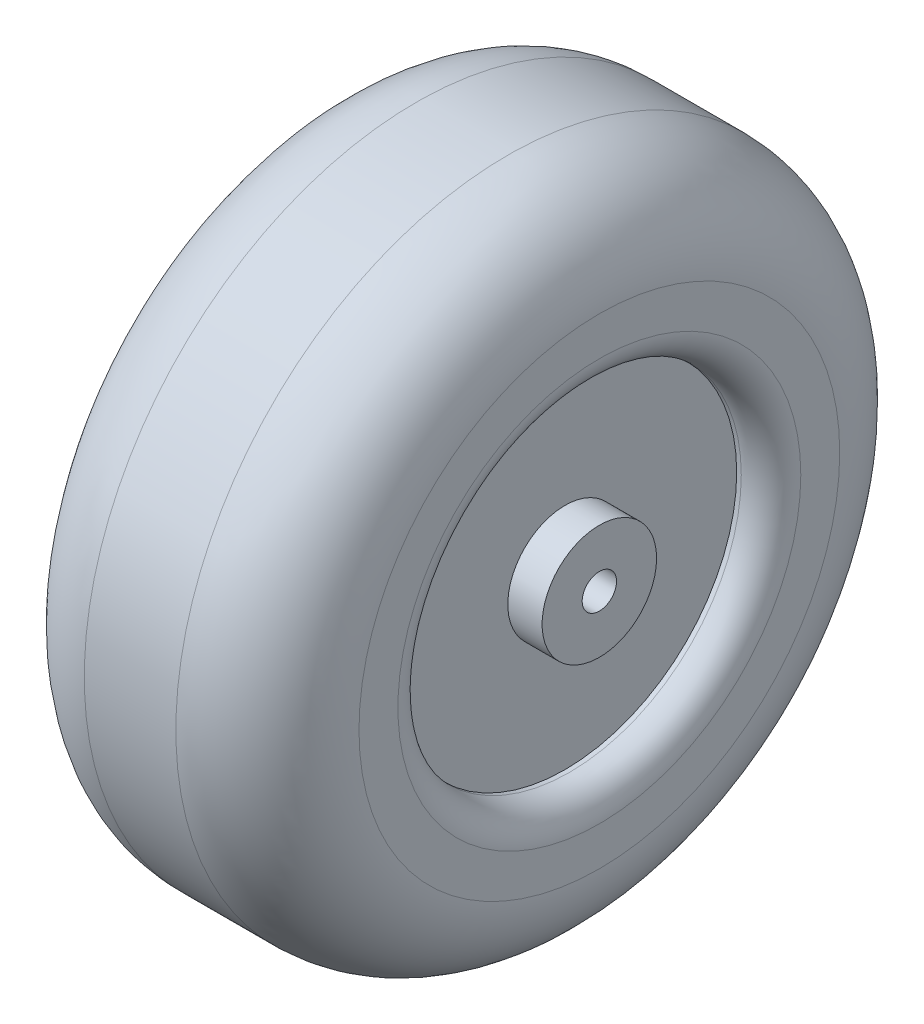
SolidWorks part; units mm, degrees
ref_plane "Plan de face" through (0, 0, 0) normal (0, 0, 1) x (1, 0, 0)
ref_plane "Plan de dessus" through (0, 0, 0) normal (0, 1, 0) x (1, 0, 0)
ref_plane "Plan de droite" through (0, 0, 0) normal (1, 0, 0) x (0, 0, -1)
sketch "Esquisse3" plane through (0, 0, 0) normal (1, 0, 0) x (0, 0, -1)
  circle A0 centre (0, 0) radius 14.5
  circle A1 centre (0, 0) radius 0.75
extrude "Boss.-Extru.1" add sketch "Esquisse3" along normal blind 12
sketch "Esquisse4" plane through (12, 0, 0) normal (1, 0, 0) x (0, 0, -1)
  circle A0 centre (0, 0) radius 2.5
  circle A1 centre (0, 0) radius 7.5
extrude "Enlèv. mat.-Extru.1" cut sketch "Esquisse4" against normal blind 1.5
sketch "Esquisse5" plane through (0, 0, 0) normal (-1, 0, 0) x (0, 0, 1)
  circle A0 centre (0, 0) radius 2.5
  circle A1 centre (0, 0) radius 7.5
extrude "Enlèv. mat.-Extru.2" cut sketch "Esquisse5" against normal blind 1.5
fillet "Congé1" radius 4 2 edges at (0, 0, -14.5) (12, 0, -14.5)
fillet "Congé2" radius 1.3 2 edges at (12, 0, -7.5) (0, 0, 7.5)
